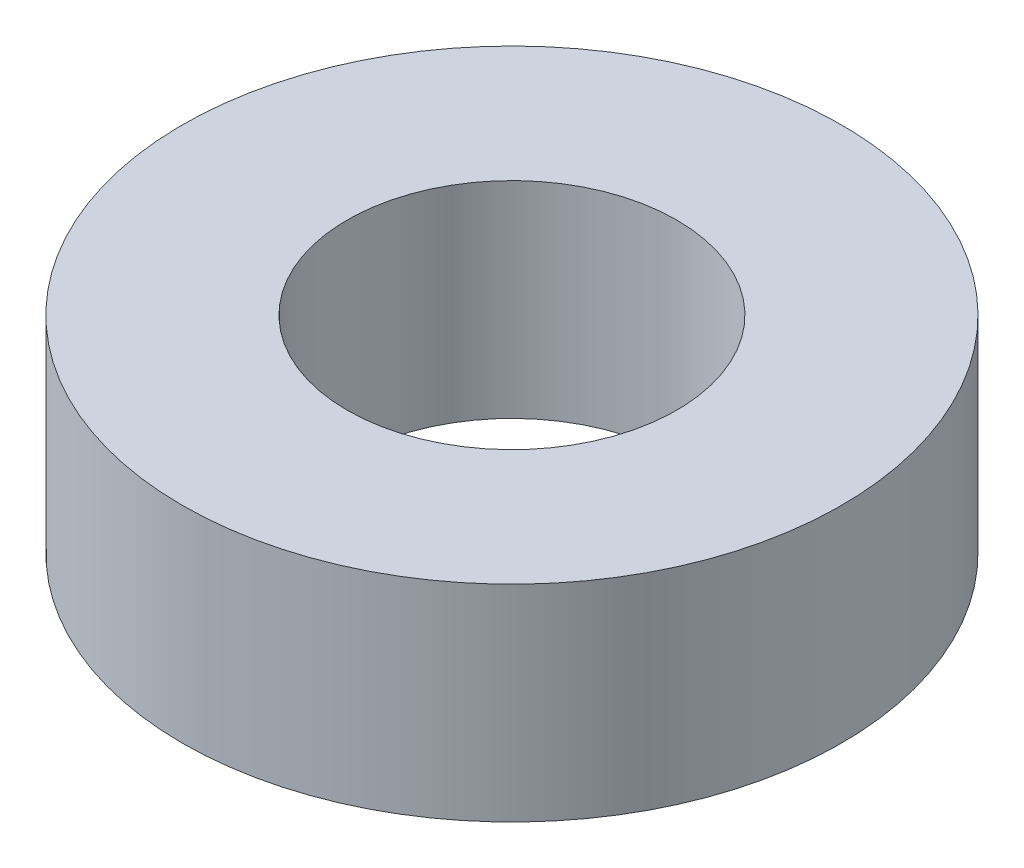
SolidWorks part; units mm, degrees
ref_plane "前视基准面" through (0, 0, 0) normal (0, 0, 1) x (1, 0, 0)
ref_plane "上视基准面" through (0, 0, 0) normal (0, 1, 0) x (1, 0, 0)
ref_plane "右视基准面" through (0, 0, 0) normal (1, 0, 0) x (0, 0, -1)
sketch "草图1" plane through (0, 0, 0) normal (0, 1, 0) x (1, 0, 0)
  circle A0 centre (0, 0) radius 4
  circle A1 centre (0, 0) radius 8
  dimension "D1" = 16
  dimension "D2" = 8
extrude "凸台-拉伸1" add sketch "草图1" along normal blind 5
